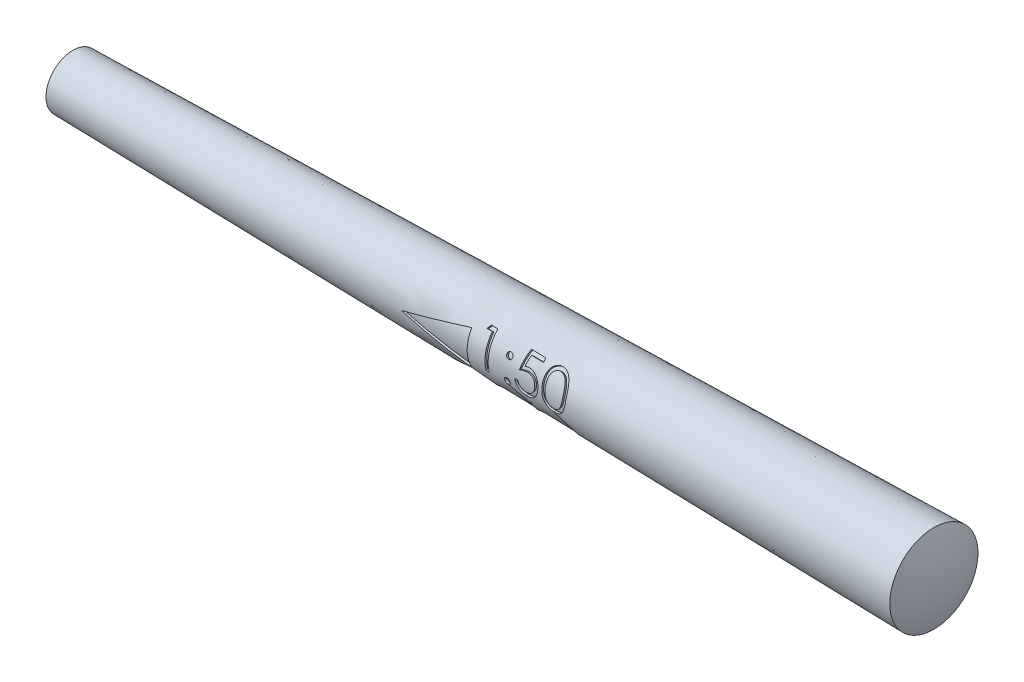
SolidWorks part; units mm, degrees
ref_plane "Front Plane" through (0, 0, 0) normal (0, 0, 1) x (1, 0, 0)
ref_plane "Top Plane" through (0, 0, 0) normal (0, 1, 0) x (1, 0, 0)
ref_plane "Right Plane" through (0, 0, 0) normal (1, 0, 0) x (0, 0, -1)
sketch "Sketch1" plane through (0, 0, 0) normal (1, 0, 0) x (0, 0, -1)
  circle A0 centre (0, 0) radius 0.75
  dimension "D1" = 1.5
extrude "Extrude1" add sketch "Sketch1" along normal mid plane 24
draft "Draft1" type of draft neutral plane draft angle 1.146 faces to draft 1 parameters "D1"=1.146
sketch "Sketch2" plane through (0, 0, 0) normal (0, 0, 1) x (1, 0, 0)
  line L0 (-12, 0) -> (-12, 0.75)
  line L1 (-12, 0.75) -> (-12, -0.75) construction
  line L2 (-12, 0) -> (-12.23, 0)
  line L3 (-12.23, 0) -> (-12.23, -0.99) construction
  line L4 (12, 0) -> (12, 1.23)
  line L5 (12, -1.23) -> (12, 1.23) construction
  line L6 (12, 0) -> (12.23, 0)
  line L7 (12.23, 0) -> (12.23, -0.99) construction
  line L8 (-12, -0.75) -> (12, -1.23) construction
  arc A0 (-12.23, 0) -> (-12, 0.75) centre (-10.8922, 0) cw
  arc A1 (12.23, 0) -> (12, 1.23) centre (8.826, 0) ccw
  point P14 (0, -0.99)
revolve "Revolve1" add sketch "Sketch2" angle 360 about L2
sketch "Sketch5" plane through (0, 0, 0) normal (0, 0, 1) x (1, 0, 0)
  line L0 (0, 0.99) -> (0, -0.99) construction
  line L1 (12, 1.23) -> (-12, 0.75) construction
  line L2 (-12, -0.75) -> (12, -1.23) construction
ref_plane "Plane2" through (0, 0, 0) normal (-0.02, 0, 0.9998) x (0.9998, 0, 0.02)
sketch "Sketch6" plane through (0, 0, 0) normal (-0.02, 0, 0.9998) x (0.9998, 0, 0.02)
  line L0 (0, 0) -> (0, 0.5)
  line L1 (0, 0.99) -> (0, -0.99) construction
  line L2 (0, 0.5) -> (-1.866, 0)
  line L3 (-1.866, 0) -> (0, -0.5)
  line L4 (0, -0.5) -> (0, 0)
  line L5 (0, -0.25) -> (3, -0.25) construction
  text T0 "1:50" font "Century Gothic" height 1
  dimension "D1" = 1
  dimension "D2" = 30
  dimension "D3" = 3
wrap "Wrap2" sketch "Sketch6" wrap type deboss source sketch "Sketch6" thickness 0.05 parameters "D1"=0.05
equation "\"D2@Sketch2\" = \"D1@Sketch2\""
